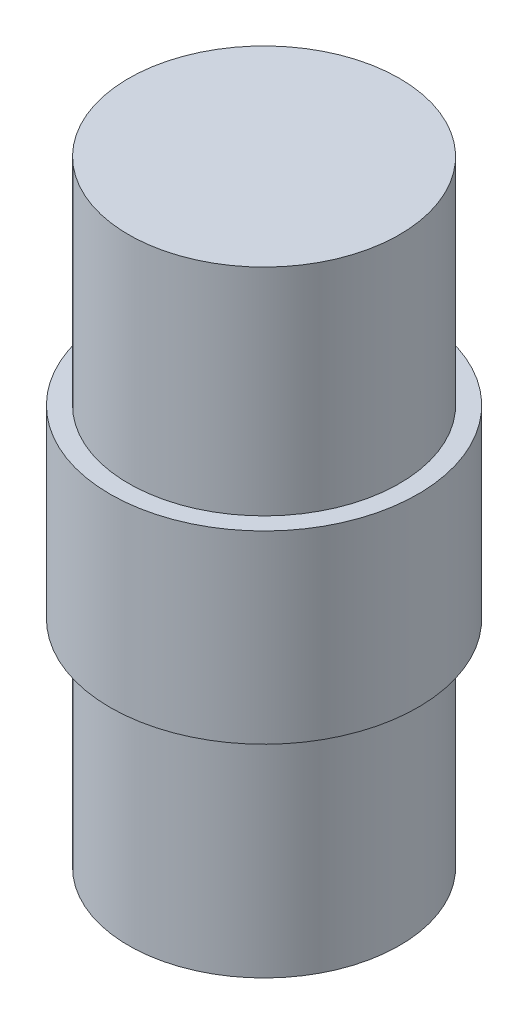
SolidWorks part; units mm, degrees
ref_plane "Front Plane" through (0, 0, 0) normal (0, 0, 1) x (1, 0, 0)
ref_plane "Top Plane" through (0, 0, 0) normal (0, 1, 0) x (1, 0, 0)
ref_plane "Right Plane" through (0, 0, 0) normal (1, 0, 0) x (0, 0, -1)
sketch "Sketch1" plane through (0, 0, 0) normal (0, 1, 0) x (1, 0, 0)
  circle A0 centre (0, 0) radius 25
  circle A1 centre (0, 0) radius 22
  dimension "D1" = 50
  dimension "D2" = 3
extrude "Extrude1" add sketch "Sketch1" along normal mid plane 30
sketch "Sketch3" plane through (0, 0, 0) normal (0, 1, 0) x (1, 0, 0)
  circle A0 centre (0, 0) radius 22 construction
  circle A1 centre (0, 0) radius 22
extrude "Extrude2" add sketch "Sketch3" along normal mid plane 100
